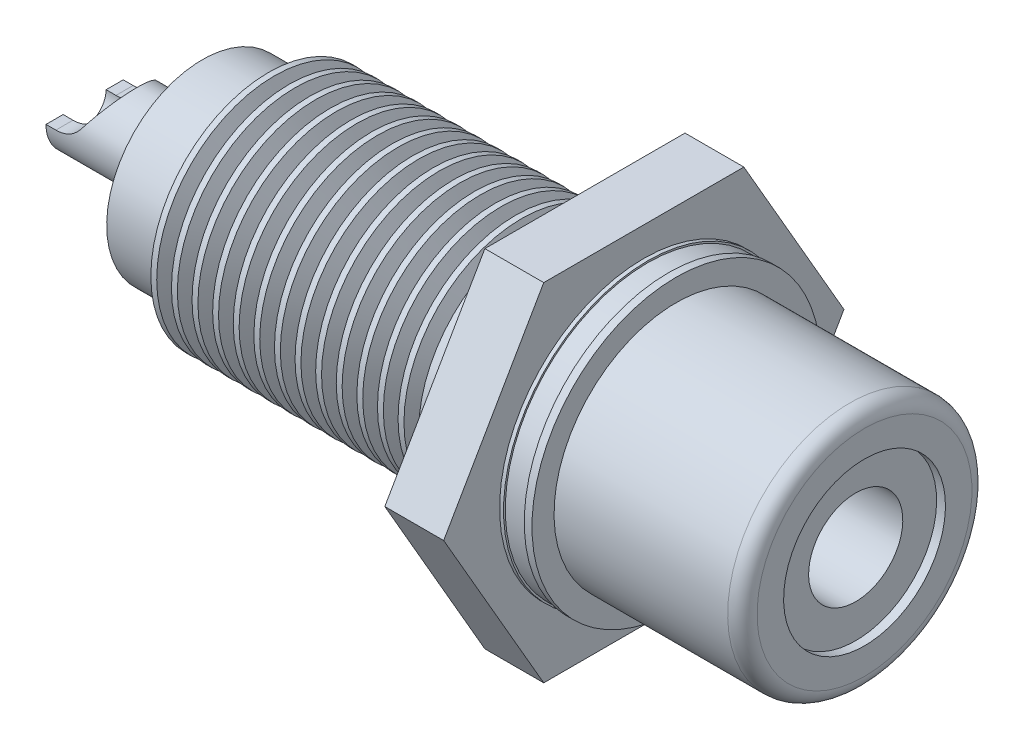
SolidWorks part; units mm, degrees
ref_plane "Front Plane" through (0, 0, 0) normal (0, 0, 1) x (1, 0, 0)
ref_plane "Top Plane" through (0, 0, 0) normal (0, 1, 0) x (1, 0, 0)
ref_plane "Right Plane" through (0, 0, 0) normal (1, 0, 0) x (0, 0, -1)
sketch "Sketch1" plane through (0, 0, 0) normal (0, 0, 1) x (1, 0, 0)
  line L0 (-21.338, 0) -> (1.162, 0) construction
  line L1 (0.662, 4.15) -> (-5.238, 4.15)
  line L2 (-21.338, 0) -> (1.162, 0)
  line L3 (-21.338, 1.3119) -> (-21.338, 3.25)
  line L4 (-8.338, 6.8) -> (-6.338, 6.8)
  line L5 (1.162, 0) -> (1.162, 3.65)
  line L6 (-5.238, 4.15) -> (-5.238, 4.9)
  line L7 (-5.238, 4.9) -> (-5.5002, 4.9)
  line L8 (-6.338, 6.8) -> (-8.338, 6.8)
  line L9 (-6.338, 6.8) -> (-6.338, 4.9)
  line L10 (-8.338, 6.8) -> (-8.338, 4)
  line L11 (-8.338, 4) -> (-9.988, 4)
  line L12 (-19.338, 3.5) -> (-19.338, 3.25)
  line L13 (-19.338, 3.25) -> (-21.338, 3.25)
  line L14 (-6.2038, 4.9) -> (-6.2038, 4.8413)
  line L15 (-6.2038, 4.8413) -> (-5.5002, 4.8413)
  line L16 (-5.5002, 4.8413) -> (-5.5002, 4.9)
  line L17 (-6.2038, 4.9) -> (-6.338, 4.9)
  line L18 (-19.088, 4) -> (-19.088, 0) construction
  line L19 (-18.888, 4) -> (-18.888, 0) construction
  line L20 (-18.638, 4) -> (-18.638, 0) construction
  line L21 (-19.338, 3.5) -> (-8.338, 3.5) construction
  line L22 (-19.338, 3.5) -> (-19.088, 4)
  line L23 (-19.088, 4) -> (-18.888, 4)
  line L24 (-18.888, 4) -> (-18.638, 3.5)
  line L25 (-18.638, 3.5) -> (-18.388, 4)
  line L26 (-8.338, 4) -> (-9.988, 4)
  line L27 (-18.188, 4) -> (-17.938, 3.5)
  line L28 (-17.938, 3.5) -> (-17.688, 4)
  line L29 (-21.338, 1.3119) -> (-25.338, 1.3119)
  line L30 (-17.488, 4) -> (-17.238, 3.5)
  line L31 (-17.238, 3.5) -> (-16.988, 4)
  line L32 (-25.338, 1.3119) -> (-25.338, 0)
  line L33 (-16.788, 4) -> (-16.538, 3.5)
  line L34 (-16.538, 3.5) -> (-16.288, 4)
  line L35 (-25.338, 0) -> (-21.338, 0)
  line L36 (-16.088, 4) -> (-15.838, 3.5)
  line L37 (-15.838, 3.5) -> (-15.588, 4)
  line L39 (-15.388, 4) -> (-15.138, 3.5)
  line L40 (-15.138, 3.5) -> (-14.888, 4)
  line L42 (-14.688, 4) -> (-14.438, 3.5)
  line L43 (-14.438, 3.5) -> (-14.188, 4)
  line L45 (-13.988, 4) -> (-13.738, 3.5)
  line L46 (-13.738, 3.5) -> (-13.488, 4)
  line L48 (-13.288, 4) -> (-13.038, 3.5)
  line L49 (-13.038, 3.5) -> (-12.788, 4)
  line L51 (-12.588, 4) -> (-12.338, 3.5)
  line L52 (-12.338, 3.5) -> (-12.088, 4)
  line L54 (-11.888, 4) -> (-11.638, 3.5)
  line L55 (-11.638, 3.5) -> (-11.388, 4)
  line L57 (-11.188, 4) -> (-10.938, 3.5)
  line L58 (-10.938, 3.5) -> (-10.688, 4)
  line L60 (-10.488, 4) -> (-10.238, 3.5)
  line L61 (-10.238, 3.5) -> (-9.988, 4)
  line L63 (-8.338, 4) -> (-9.988, 4)
  line L64 (-18.888, 4) -> (-19.088, 4)
  line L65 (-18.188, 4) -> (-18.388, 4)
  line L66 (-18.188, 4) -> (-18.388, 4)
  line L67 (-17.488, 4) -> (-17.688, 4)
  line L68 (-17.488, 4) -> (-17.688, 4)
  line L69 (-17.488, 4) -> (-17.688, 4)
  line L70 (-16.788, 4) -> (-16.988, 4)
  line L71 (-16.788, 4) -> (-16.988, 4)
  line L72 (-16.788, 4) -> (-16.988, 4)
  line L73 (-16.788, 4) -> (-16.988, 4)
  line L74 (-16.088, 4) -> (-16.288, 4)
  line L75 (-16.088, 4) -> (-16.288, 4)
  line L76 (-16.088, 4) -> (-16.288, 4)
  line L77 (-16.088, 4) -> (-16.288, 4)
  line L78 (-16.088, 4) -> (-16.288, 4)
  line L79 (-15.388, 4) -> (-15.588, 4)
  line L80 (-15.388, 4) -> (-15.588, 4)
  line L81 (-15.388, 4) -> (-15.588, 4)
  line L82 (-15.388, 4) -> (-15.588, 4)
  line L83 (-15.388, 4) -> (-15.588, 4)
  line L84 (-15.388, 4) -> (-15.588, 4)
  line L85 (-14.688, 4) -> (-14.888, 4)
  line L86 (-14.688, 4) -> (-14.888, 4)
  line L87 (-14.688, 4) -> (-14.888, 4)
  line L88 (-14.688, 4) -> (-14.888, 4)
  line L89 (-14.688, 4) -> (-14.888, 4)
  line L90 (-14.688, 4) -> (-14.888, 4)
  line L91 (-14.688, 4) -> (-14.888, 4)
  line L92 (-13.988, 4) -> (-14.188, 4)
  line L93 (-13.988, 4) -> (-14.188, 4)
  line L94 (-13.988, 4) -> (-14.188, 4)
  line L95 (-13.988, 4) -> (-14.188, 4)
  line L96 (-13.988, 4) -> (-14.188, 4)
  line L97 (-13.988, 4) -> (-14.188, 4)
  line L98 (-13.988, 4) -> (-14.188, 4)
  line L99 (-13.988, 4) -> (-14.188, 4)
  line L100 (-13.288, 4) -> (-13.488, 4)
  line L101 (-13.288, 4) -> (-13.488, 4)
  line L102 (-13.288, 4) -> (-13.488, 4)
  line L103 (-13.288, 4) -> (-13.488, 4)
  line L104 (-13.288, 4) -> (-13.488, 4)
  line L105 (-13.288, 4) -> (-13.488, 4)
  line L106 (-13.288, 4) -> (-13.488, 4)
  line L107 (-13.288, 4) -> (-13.488, 4)
  line L108 (-13.288, 4) -> (-13.488, 4)
  line L109 (-12.588, 4) -> (-12.788, 4)
  line L110 (-12.588, 4) -> (-12.788, 4)
  line L111 (-12.588, 4) -> (-12.788, 4)
  line L112 (-12.588, 4) -> (-12.788, 4)
  line L113 (-12.588, 4) -> (-12.788, 4)
  line L114 (-12.588, 4) -> (-12.788, 4)
  line L115 (-12.588, 4) -> (-12.788, 4)
  line L116 (-12.588, 4) -> (-12.788, 4)
  line L117 (-12.588, 4) -> (-12.788, 4)
  line L118 (-12.588, 4) -> (-12.788, 4)
  line L119 (-11.888, 4) -> (-12.088, 4)
  line L120 (-11.888, 4) -> (-12.088, 4)
  line L121 (-11.888, 4) -> (-12.088, 4)
  line L122 (-11.888, 4) -> (-12.088, 4)
  line L123 (-11.888, 4) -> (-12.088, 4)
  line L124 (-11.888, 4) -> (-12.088, 4)
  line L125 (-11.888, 4) -> (-12.088, 4)
  line L126 (-11.888, 4) -> (-12.088, 4)
  line L127 (-11.888, 4) -> (-12.088, 4)
  line L128 (-11.888, 4) -> (-12.088, 4)
  line L129 (-11.888, 4) -> (-12.088, 4)
  line L130 (-11.188, 4) -> (-11.388, 4)
  line L131 (-11.188, 4) -> (-11.388, 4)
  line L132 (-11.188, 4) -> (-11.388, 4)
  line L133 (-11.188, 4) -> (-11.388, 4)
  line L134 (-11.188, 4) -> (-11.388, 4)
  line L135 (-11.188, 4) -> (-11.388, 4)
  line L136 (-11.188, 4) -> (-11.388, 4)
  line L137 (-11.188, 4) -> (-11.388, 4)
  line L138 (-11.188, 4) -> (-11.388, 4)
  line L139 (-11.188, 4) -> (-11.388, 4)
  line L140 (-11.188, 4) -> (-11.388, 4)
  line L141 (-11.188, 4) -> (-11.388, 4)
  line L142 (-10.488, 4) -> (-10.688, 4)
  line L143 (-10.488, 4) -> (-10.688, 4)
  line L144 (-10.488, 4) -> (-10.688, 4)
  line L145 (-10.488, 4) -> (-10.688, 4)
  line L146 (-10.488, 4) -> (-10.688, 4)
  line L147 (-10.488, 4) -> (-10.688, 4)
  line L148 (-10.488, 4) -> (-10.688, 4)
  line L149 (-10.488, 4) -> (-10.688, 4)
  line L150 (-10.488, 4) -> (-10.688, 4)
  line L151 (-10.488, 4) -> (-10.688, 4)
  line L152 (-10.488, 4) -> (-10.688, 4)
  line L153 (-10.488, 4) -> (-10.688, 4)
  line L154 (-10.488, 4) -> (-10.688, 4)
  line L155 (-9.788, 4) -> (-9.538, 3.5)
  line L156 (-8.338, 4) -> (-9.988, 4)
  line L157 (-8.338, 4) -> (-9.988, 4)
  line L158 (-8.338, 4) -> (-9.988, 4)
  line L159 (-8.338, 4) -> (-9.988, 4)
  line L160 (-8.338, 4) -> (-9.988, 4)
  line L161 (-8.338, 4) -> (-9.988, 4)
  line L162 (-8.338, 4) -> (-9.988, 4)
  line L163 (-8.338, 4) -> (-9.988, 4)
  line L164 (-8.338, 4) -> (-9.988, 4)
  line L165 (-8.338, 4) -> (-9.988, 4)
  line L166 (-8.338, 4) -> (-9.988, 4)
  line L167 (-6.938, 4) -> (-7.638, 4)
  line L168 (-6.238, 4) -> (-7.638, 4)
  line L169 (-5.538, 4) -> (-7.638, 4)
  line L170 (-4.838, 4) -> (-7.638, 4)
  line L171 (-4.138, 4) -> (-7.638, 4)
  line L172 (-3.438, 4) -> (-7.638, 4)
  line L173 (-2.738, 4) -> (-7.638, 4)
  line L174 (-2.038, 4) -> (-7.638, 4)
  line L175 (-1.338, 4) -> (-7.638, 4)
  line L176 (-0.638, 4) -> (-7.638, 4)
  line L177 (0.062, 4) -> (-7.638, 4)
  line L178 (0.762, 4) -> (-7.638, 4)
  arc A0 (1.162, 3.65) -> (0.662, 4.15) centre (0.662, 3.65) ccw
  point P27 (1.162, 4.15)
  dimension "D9" = 0.5
  dimension "D1" = 22.5
  dimension "D2" = 6.8
  dimension "D3" = 4.15
  dimension "D4" = 4.9
  dimension "D5" = 4
  dimension "D6" = 3.25
  dimension "D7" = 6.4
  dimension "D8" = 2
  dimension "D10" = 2
  dimension "D11" = 4
  dimension "D13" = 0.25
  dimension "D15" = 14
revolve "Revolve1" add sketch "Sketch1" angle 360 about L2
sketch "Sketch2" plane through (-6.338, 0, 0) normal (1, 0, 0) x (0, 0, -1)
  line L1 (6.8, 0) -> (3.4, 5.889)
  line L2 (3.4, 5.889) -> (-3.4, 5.889)
  line L3 (-3.4, 5.889) -> (-6.8, 0)
  line L4 (-6.8, 0) -> (-3.4, -5.889)
  line L5 (-3.4, -5.889) -> (3.4, -5.889)
  line L6 (3.4, -5.889) -> (6.8, 0)
  circle A0 centre (0, 0) radius 5.889 construction
  circle A1 centre (0, 0) radius 6.8
extrude "Cut-Extrude1" cut sketch "Sketch2" against normal blind 10 contours L3 M2 | L4 M2 | L5 M2 | L6 M2 | L1 M2 | L2 M2
sketch "Sketch3" plane through (1.162, 0, 0) normal (1, 0, 0) x (0, 0, -1)
  circle A0 centre (0, 0) radius 1.6
  dimension "D1" = 3.2
extrude "Cut-Extrude2" cut sketch "Sketch3" against normal blind 16
sketch "Sketch4" plane through (1.162, 0, 0) normal (1, 0, 0) x (0, 0, -1)
  circle A0 centre (0, 0) radius 2.75
  dimension "D1" = 5.5
extrude "Cut-Extrude3" cut sketch "Sketch4" against normal blind 0.3
sketch "Sketch6" plane through (0, 0, 0) normal (0, 0, 1) x (1, 0, 0)
  line L0 (-25.338, 1.3119) -> (-25.338, 0)
  line L1 (-25.338, 1.3119) -> (-25.338, -1.3119) construction
  line L2 (-25.338, 0) -> (-25.0028, 0)
  line L3 (-24.1826, 0.4279) -> (-23.5661, 1.3119)
  line L4 (-23.5661, 1.3119) -> (-25.338, 1.3119)
  arc A0 (-25.0028, 0) -> (-24.1826, 0.4279) centre (-25.0028, 1) ccw
  dimension "D1" = 1
extrude "Cut-Extrude4" cut sketch "Sketch6" against normal mid plane 11
sketch "Sketch7" plane through (-25.338, 0, 0) normal (-1, 0, 0) x (0, 0, 1)
  circle A0 centre (0, 0) radius 0.7302
extrude "Cut-Extrude5" cut sketch "Sketch7" against normal blind 11
